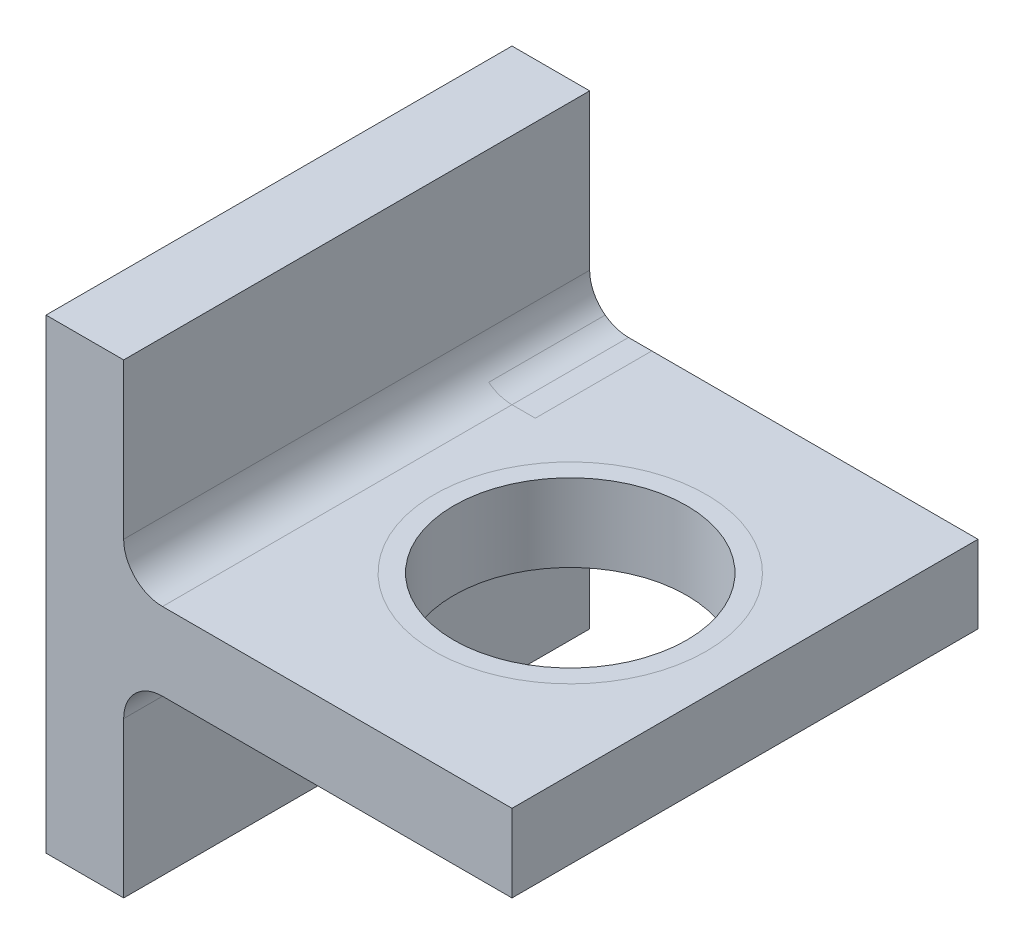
SolidWorks part; units mm, degrees
ref_plane "Front" through (0, 0, 0) normal (0, 0, 1) x (1, 0, 0)
ref_plane "Top" through (0, 0, 0) normal (0, 1, 0) x (1, 0, 0)
ref_plane "Right" through (0, 0, 0) normal (1, 0, 0) x (0, 0, -1)
sketch "Sketch1" plane through (0, 0, 0) normal (0, 0, 1) x (1, 0, 0)
  line L0 (-30.4308, 0) -> (136.341, 0) construction
  line L1 (0, -60) -> (20, -60)
  line L2 (0, -60) -> (0, 60)
  line L3 (0, 60) -> (20, 60)
  line L4 (20, -60) -> (20, -10)
  line L5 (20, -10) -> (120, -10)
  line L6 (20, 10) -> (120, 10)
  line L7 (120, 10) -> (120, -10)
  line L8 (20, 10) -> (20, 60)
  point P13 (20, 10)
  point P15 (20, -10)
  dimension "D1" = 60
  dimension "D2" = 120
  dimension "D4" = 20
  dimension "D5" = 100
extrude "Base-Extrude" add sketch "Sketch1" along normal mid plane 120
sketch "Sketch2" plane through (0, 0, 0) normal (0, 1, 0) x (-1, 0, 0)
  line L0 (-120, 60) -> (-20, 60) construction
  line L1 (-120, 60) -> (-120, -60) construction
  circle A0 centre (-75, 0) radius 30
  dimension "D1" = 60
  dimension "D3" = 45
  dimension "D2" = 60
fillet "Fillet1" radius 10 2 edges at (20, -10, 0) (20, 10, 0)
extrude "Extrude1" cut sketch "Sketch2" against normal through all and the other way through all
sketch "Sketch3" plane through (0, 10, 0) normal (0, 1, 0) x (1, 0, 0)
  circle A0 centre (75, 0) radius 35
  circle A1 centre (75, 0) radius 30 construction
  dimension "D1" = 70
fillet "fillet 2mm" [suppressed] radius 2
sketch "Sketch5" plane through (0, 0, 0) normal (0, 1, 0) x (1, 0, 0)
  line L0 (120, 60) -> (30, 60) construction
  line L1 (36, 60) -> (30, 60)
  line L3 (30, 60) -> (20, 60) construction
  line L4 (30, 60) -> (24, 60)
  line L5 (24, 60) -> (24, 30)
  line L6 (24, 30) -> (36, 30)
  line L7 (36, 30) -> (36, 60)
  dimension "D1" = 30
  dimension "D2" = 6
  dimension "D3" = 12
sketch "Sketch4" plane through (0, 0, 0) normal (0, 1, 0) x (1, 0, 0)
  line L0 (-13.1941, 0) -> (132.1397, 0)
extrude "Extrude2" [suppressed] cut sketch "Sketch4" against normal through all and the other way through all flip side to cut
